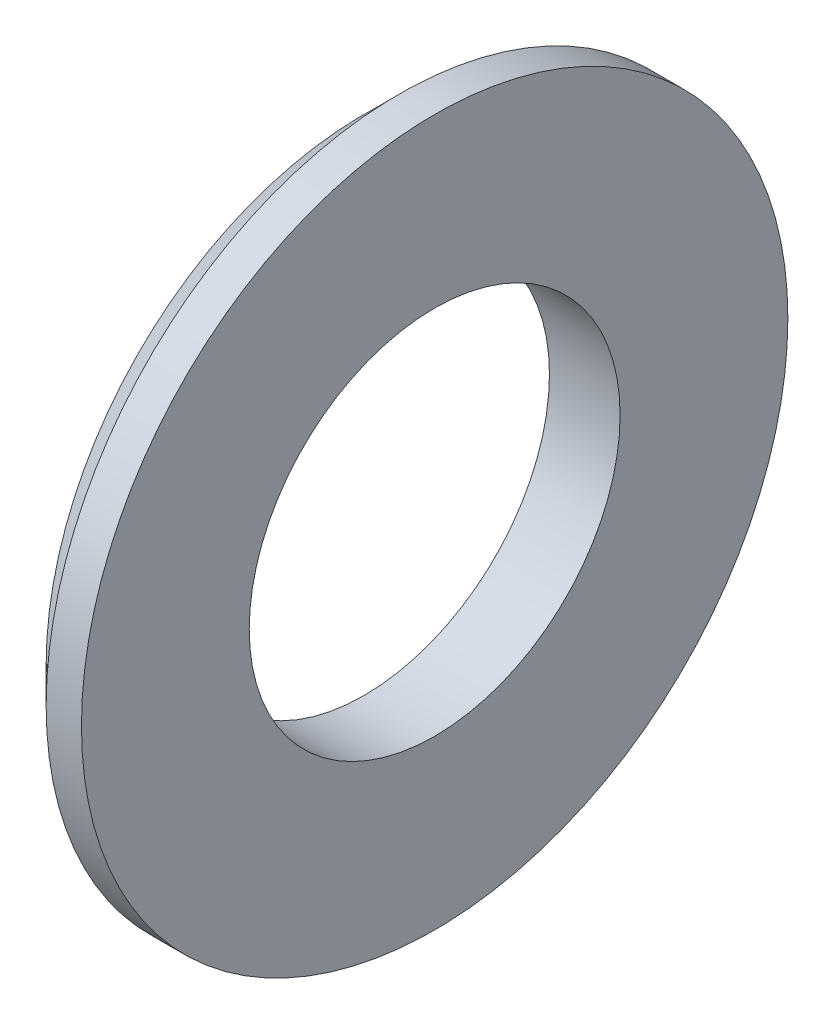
SolidWorks part; units mm, degrees
ref_plane "Plane1" through (0, 0, 0) normal (0, 0, 1) x (1, 0, 0)
ref_plane "Plane2" through (0, 0, 0) normal (0, 1, 0) x (1, 0, 0)
ref_plane "Plane3" through (0, 0, 0) normal (1, 0, 0) x (0, 0, -1)
revolve "Base-Revolve" add sketch "Sketch1" angle 360 about L0
sketch "Sketch1" plane through (0, 0, 0) normal (0, 0, 1) x (1, 0, 0)
  line L0 (-34.925, 0) -> (9.525, 0) construction
  line L1 (0, 5.25) -> (0, 10)
  line L2 (0, 10) -> (-1, 10)
  line L3 (-2, 9) -> (-2, 5.25)
  line L4 (-2, 5.25) -> (0, 5.25)
  line L5 (-2, 9) -> (-1, 10)
  dimension "D2" = 45
  dimension "D3" = 1
  dimension "Thickness" = 2
  dimension "Inside_dia" = 10.5
  dimension "Outside_dia" = 20
equation "\"D3@Sketch1\" = \"Thickness@Sketch1\" * .5"
